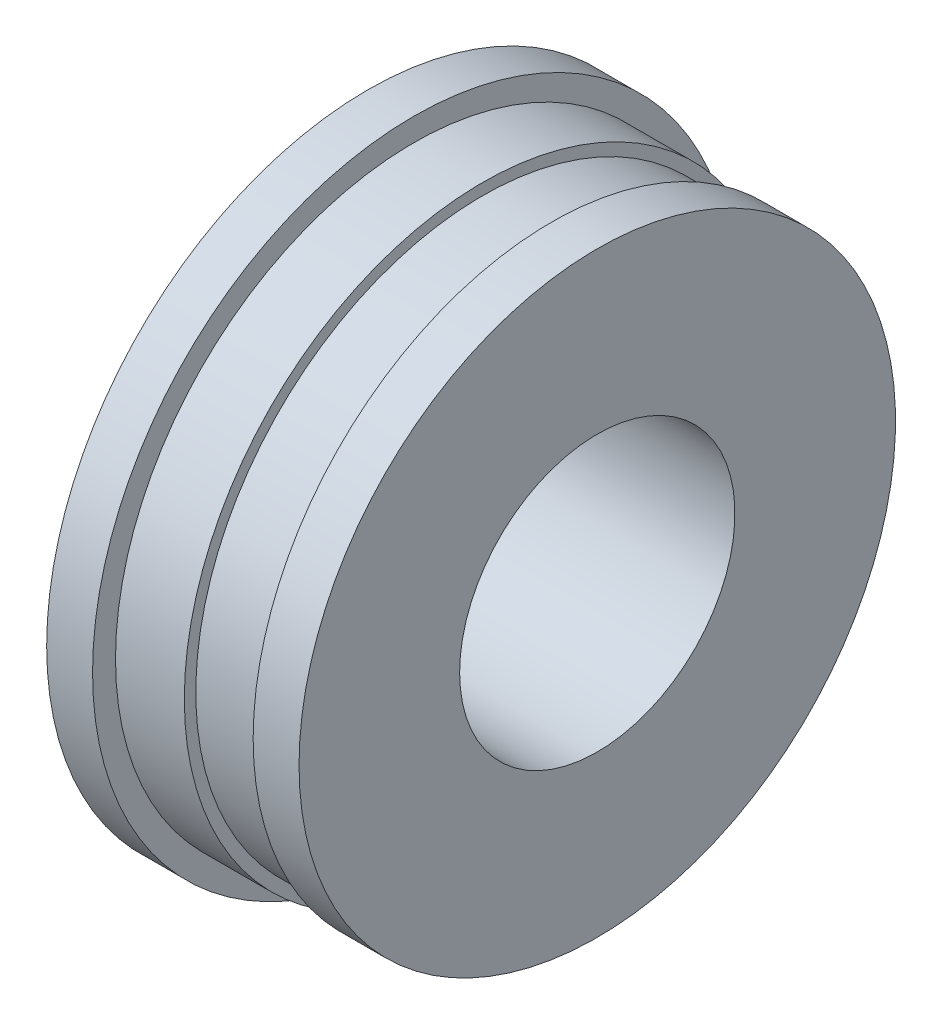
SolidWorks part; units mm, degrees
ref_plane "Face" through (0, 0, 0) normal (0, 0, 1) x (1, 0, 0)
ref_plane "Dessus" through (0, 0, 0) normal (0, 1, 0) x (1, 0, 0)
ref_plane "Droite" through (0, 0, 0) normal (1, 0, 0) x (0, 0, -1)
sketch "Esquisse1" plane through (0, 0, 0) normal (0, 0, 1) x (1, 0, 0)
  line L0 (0, 0) -> (42.1949, 0) construction
  line L2 (0, 6) -> (0, 14)
  line L3 (0, 14) -> (2, 14)
  line L4 (2, 13) -> (2, 14)
  line L5 (0, 6) -> (10, 6)
  line L7 (2, 13) -> (10, 13)
  line L8 (10, 6) -> (10, 13)
  dimension "D1" = 6
  dimension "D2" = 14
  dimension "D3" = 13
  dimension "D4" = 2
  dimension "D5" = 10
revolve "Révolution1" add sketch "Esquisse1" angle 360 about L0
sketch "Esquisse2" plane through (0, 0, 0) normal (0, 0, 1) x (1, 0, 0)
  line L0 (10, -13) -> (10, 13) construction
  line L1 (5, 18.949) -> (8, 18.949)
  line L2 (5, 18.949) -> (5, 12.5)
  line L3 (5, 12.5) -> (8, 12.5)
  line L4 (8, 18.949) -> (8, 12.5)
  line L5 (10, 13) -> (2, 13) construction
  line L6 (49.5427, 0) -> (-10.0496, 0) construction
  dimension "D1" = 3
  dimension "D2" = 2
  dimension "D3" = 0.5
revolve "Enlèvement de matière-Révolution1" cut sketch "Esquisse2" angle 360 about L6
